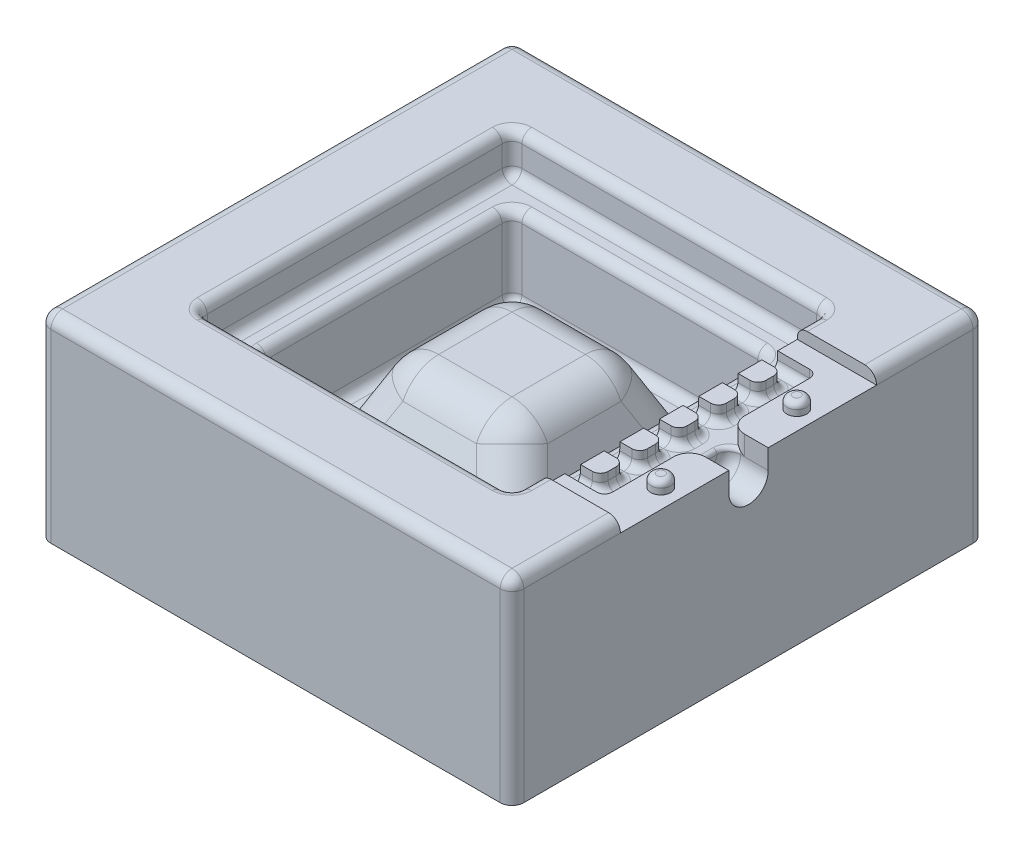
SolidWorks part; units mm, degrees
ref_plane "Front Plane" through (0, 0, 0) normal (0, 0, 1) x (1, 0, 0)
ref_plane "Top Plane" through (0, 0, 0) normal (0, 1, 0) x (1, 0, 0)
ref_plane "Right Plane" through (0, 0, 0) normal (1, 0, 0) x (0, 0, -1)
sketch "Sketch1" plane through (0, 0, 0) normal (0, 1, 0) x (1, 0, 0)
  line L0 (-60, 60) -> (60, -60) construction
  line L1 (-60, 60) -> (60, 60)
  line L2 (-60, 60) -> (-60, -60)
  line L3 (-60, -60) -> (60, -60)
  line L4 (60, 60) -> (60, -60)
  dimension "D1" = 120
  dimension "D2" = 120
extrude "Boss-Extrude1" add sketch "Sketch1" along normal blind 50
sketch "Sketch2" plane through (0, 50, 0) normal (0, 1, 0) x (1, 0, 0)
  line L0 (-40, -40) -> (40, 40) construction
  line L1 (-40, -40) -> (40, -40)
  line L2 (-40, -40) -> (-40, 40)
  line L3 (-40, 40) -> (40, 40)
  line L4 (40, -40) -> (40, 40)
  dimension "D1" = 80
  dimension "D2" = 80
extrude "Cut-Extrude3" cut sketch "Sketch2" against normal blind 10 draft 2
sketch "Sketch3" plane through (0, 40, 0) normal (0, 1, 0) x (1, 0, 0)
  line L0 (-32.5, 32.5) -> (32.5, -32.5) construction
  line L1 (-32.5, -32.5) -> (32.5, -32.5)
  line L2 (-32.5, -32.5) -> (-32.5, 32.5)
  line L3 (-32.5, 32.5) -> (32.5, 32.5)
  line L4 (32.5, -32.5) -> (32.5, 32.5)
  dimension "D1" = 65
  dimension "D2" = 65
extrude "Cut-Extrude4" cut sketch "Sketch3" against normal blind 20 draft 2
sketch "Sketch4" plane through (0, 20, 0) normal (0, 1, 0) x (1, 0, 0)
  line L0 (-25, 25) -> (25, -25) construction
  line L1 (-25, -25) -> (25, -25)
  line L2 (-25, -25) -> (-25, 25)
  line L3 (-25, 25) -> (25, 25)
  line L4 (25, -25) -> (25, 25)
  dimension "D1" = 50
  dimension "D2" = 50
extrude "Boss-Extrude2" add sketch "Sketch4" along normal blind 20 draft 25
fillet "Fillet1" radius 10 8 edges at (-15.6738, 40, 0) (0, 40, -15.6738) (15.6738, 40, 0) (0, 40, 15.6738) (-20.3369, 30, 20.3369) (20.3369, 30, 20.3369) (20.3369, 30, -20.3369) (-20.3369, 30, -20.3369)
fillet "Fillet11" radius 3 8 edges at (-60, 50, 0) (0, 50, -60) (60, 50, 0) (0, 50, 60) (60, 25, -60) (-60, 25, -60) (-60, 25, 60) (60, 25, 60)
sketch "Sketch5" plane through (0, 50, 0) normal (0, 1, 0) x (1, 0, 0)
  line L3 (32.5, -32.5) -> (32.5, 32.5) construction
  line L4 (60, -60) -> (60, 60) construction
  line L5 (32.5, -32.5) -> (32.5, 32.5)
  line L6 (60, -32.5) -> (60, 32.5)
  line L7 (32.5, 32.5) -> (60, 32.5)
  line L8 (32.5, -32.5) -> (60, -32.5)
extrude "Cut-Extrude6" cut sketch "Sketch5" against normal blind 3
sketch "Sketch7" plane through (60, 0, 0) normal (1, 0, 0) x (0, 0, -1)
  line L0 (0, 0) -> (0, 71.4405) construction
  line L1 (-57, 0) -> (57, 0) construction
  line L2 (-32.5, 47) -> (32.5, 47) construction
  line L3 (-5, 42) -> (-5, 47)
  line L4 (5, 42) -> (5, 47)
  line L5 (-5, 47) -> (5, 47)
  arc A0 (-5, 42) -> (5, 42) centre (0, 42) ccw
  dimension "D1" = 10
extrude "Cut-Extrude8" cut sketch "Sketch7" against normal blind 10
sketch "Sketch8" plane through (0, 47, 0) normal (0, 1, 0) x (1, 0, 0)
  line L0 (39.8952, 32.5) -> (39.8952, -32.5) construction
  line L1 (32.5, 27.5) -> (44.8952, 27.5)
  line L2 (32.5, 27.5) -> (32.5, 23.5)
  line L3 (32.5, 23.5) -> (44.8952, 23.5)
  line L4 (44.8952, 27.5) -> (44.8952, 23.5)
  line L5 (60, 32.5) -> (39.8952, 32.5) construction
  line L6 (32.5, -32.5) -> (32.5, 32.5) construction
  line L7 (44.8952, 32.5) -> (44.8952, -32.5) construction
  dimension "D1" = 4
  dimension "D2" = 5
  dimension "D3" = 5
extrude "Cut-Extrude9" cut sketch "Sketch8" against normal blind 4
pattern_linear "LPattern1" count 6 spacing 10 along (0, 0, 1) of "Cut-Extrude9"
sketch "Sketch9" plane through (0, 47, 0) normal (0, 1, 0) x (1, 0, 0)
  line L0 (39.8952, -26.5) -> (44.8952, -26.5) construction
  line L1 (44.8952, 27.5) -> (50, 27.5)
  line L2 (44.8952, 27.5) -> (44.8952, -26.5)
  line L3 (44.8952, -26.5) -> (50, -26.5)
  line L4 (50, 27.5) -> (50, -26.5)
  line L5 (50, 5) -> (50, -5) construction
extrude "Cut-Extrude10" cut sketch "Sketch9" against normal blind 4
fillet "Fillet4" radius 2 35 edges at (39.7556, 43, -25.5) (44.8778, 43, -27.5) (42.3254, 43, -23.5) (44.8952, 45, -23.5) (39.7556, 43, -15.5) (42.3254, 43, -17.5) (42.3254, 43, -13.5) (44.8952, 45, -13.5) (44.8952, 45, -17.5) (39.7556, 43, -5.5) (42.3254, 43, -7.5) (42.3254, 43, -3.5) (44.8952, 45, -3.5) (44.8952, 45, -7.5) (39.7556, 43, 4.5) (42.3254, 43, 2.5) (42.3254, 43, 6.5) (44.8952, 45, 6.5) (44.8952, 45, 2.5) (39.7556, 43, 14.5) (42.3254, 43, 12.5) (42.3254, 43, 16.5) (44.8952, 45, 16.5) (44.8952, 45, 12.5) (39.7556, 43, 24.5) (42.3254, 43, 22.5) (44.8778, 43, 26.5) (44.8952, 45, 22.5) (50, 45, -27.5) (44.8952, 43, -20.5) (44.8952, 43, -10.5) (44.8952, 43, -0.5) (44.8952, 43, 9.5) (44.8952, 43, 19.5) (50, 45, 26.5)
fillet "Fillet7" radius 4 2 edges at (50, 45, 5) (50, 45, -5)
fillet "Fillet9" radius 3 3 edges at (50, 42.5, 5) (50, 42.5, -5) (50, 37, 0)
fillet "Fillet10" radius 1 5 edges at (53.5, 43, 5) (50.8787, 43, 4.1213) (53.5, 43, -5) (50, 43, 0) (50.8787, 43, -4.1213)
sketch "Sketch10" plane through (0, 47, 0) normal (0, 1, 0) x (1, 0, 0)
  line L0 (50, 17.25) -> (60, 17.25) construction
  line L1 (50, 9) -> (50, 25.5) construction
  line L2 (60, 5) -> (60, 32.5) construction
  circle A0 centre (55, 17.25) radius 2.5
  dimension "D1" = 5
extrude "Boss-Extrude3" add sketch "Sketch10" along normal up to surface (3 mm away)
mirror "Mirror1" about plane through (0, 0, 0) normal (0, 0, 1) of "Boss-Extrude3"
fillet "Fillet12" radius 2.5 33 edges at (-22.4364, 20, 22.4364) (-25, 20, 0) (-22.4364, 20, -22.4364) (0, 20, -25) (22.4364, 20, -22.4364) (25, 20, 0) (22.4364, 20, 22.4364) (0, 20, 25) (40, 50, 36.25) (0, 50, 40) (-40, 50, 0) (0, 50, -40) (40, 50, -36.25) (32.5, 40, 0) (0, 40, -32.5) (0, 40, 32.5) (-32.5, 40, 0) (31.8016, 20, 0) (0, 20, -31.8016) (0, 20, 31.8016) (-31.8016, 20, 0) (0, 40, 39.6508) (-39.6508, 40, 0) (-32.1508, 30, 32.1508) (-32.1508, 30, -32.1508) (32.1508, 30, -32.1508) (32.1508, 30, 32.1508) (39.8254, 45, 39.8254) (39.8254, 45, -39.8254) (-39.8254, 45, -39.8254) (-39.8254, 45, 39.8254) (39.6508, 40, 0) (0, 40, -39.6508)
fillet "Fillet13" radius 1.5 2 edges at (55, 50, -14.75) (55, 50, 19.75)
